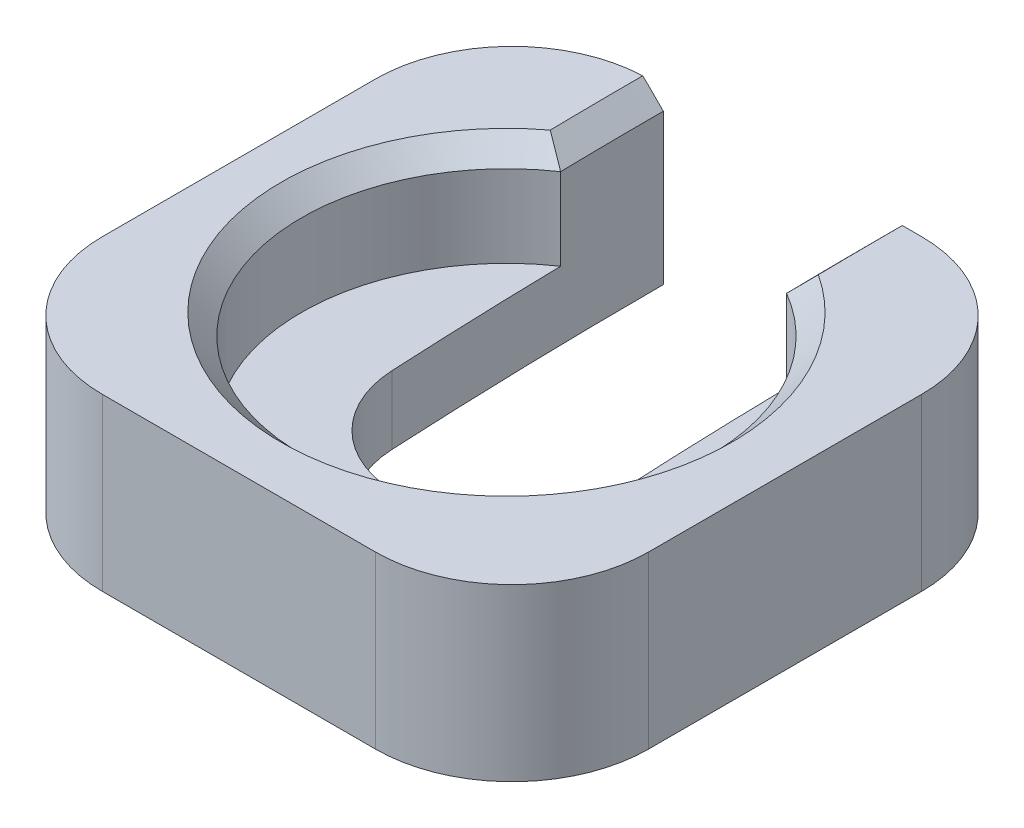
SolidWorks part; units mm, degrees
ref_plane "Front" through (0, 0, 0) normal (0, 0, 1) x (1, 0, 0)
ref_plane "Top" through (0, 0, 0) normal (0, 1, 0) x (1, 0, 0)
ref_plane "Right" through (0, 0, 0) normal (1, 0, 0) x (0, 0, -1)
sketch "Esboço1" plane through (0, 0, 0) normal (0, 1, 0) x (1, 0, 0)
  line L0 (-1.7833, 0) -> (-7.2, 0) construction
  line L1 (-7.2, 0) -> (-1.7833, 0) construction
  line L2 (78.4167, 0) -> (1.4167, 0) construction
  line L3 (0, 0) -> (0, 40.8805) construction
  line L4 (0, 40.8805) -> (0, -35.2139) construction
  line L12 (1.4167, 0) -> (4, 0)
  line L13 (4, 0) -> (4, -8)
  line L14 (-4, -8) -> (4, -8)
  line L20 (-4, 0) -> (-1.7833, 0)
  line L23 (1.4167, 0) -> (78.4167, 0) construction
  line L25 (-4, 0) -> (-4, -8)
  arc A4 (1.5165, -3.9186) -> (-1.6794, -4.0814) centre (-0.0814, -4) cw
  arc A5 (1.5165, -3.9186) -> (1.4167, 0) centre (78.4167, 0) cw
  arc A6 (-1.6794, -4.0814) -> (-1.7833, 0) centre (78.4167, 0) cw
  point P3 (0, -5.5979)
  point P23 (0, -8)
  dimension "D1" = 4
  dimension "D5" = 8
  dimension "D2" = 3.2
  dimension "D3" = 77
  dimension "D4" = 8
extrude "Ressalto-extrusão1" add sketch "Esboço1" along normal blind 2.5
sketch "Esboço2" plane through (0, 2.5, 0) normal (0, 1, 0) x (1, 0, 0)
  line L0 (0, 0) -> (-11.5783, 0) construction
  line L1 (0, 0) -> (0, -18.2093) construction
  line L2 (17.9524, 0) -> (0, 0) construction
  circle A0 centre (-0.0814, -4) radius 3
  arc A1 (-1.6794, -4.0814) -> (1.5165, -3.9186) centre (-0.0814, -4) ccw construction
  dimension "D1" = 6
extrude "Corte-extrusão1" cut sketch "Esboço2" against normal blind 1.5
chamfer "Chanfro1" distance 0.3 angle 45 3 edges at (1.4199, 2.5, 0.7042) (0.0229, 2.5, 6.9982) (-1.7797, 2.5, 0.7598)
fillet "Filete1" radius 2 4 edges at (4, 1.25, 0) (4, 1.25, 8) (-4, 1.25, 0) (-4, 1.25, 8)
